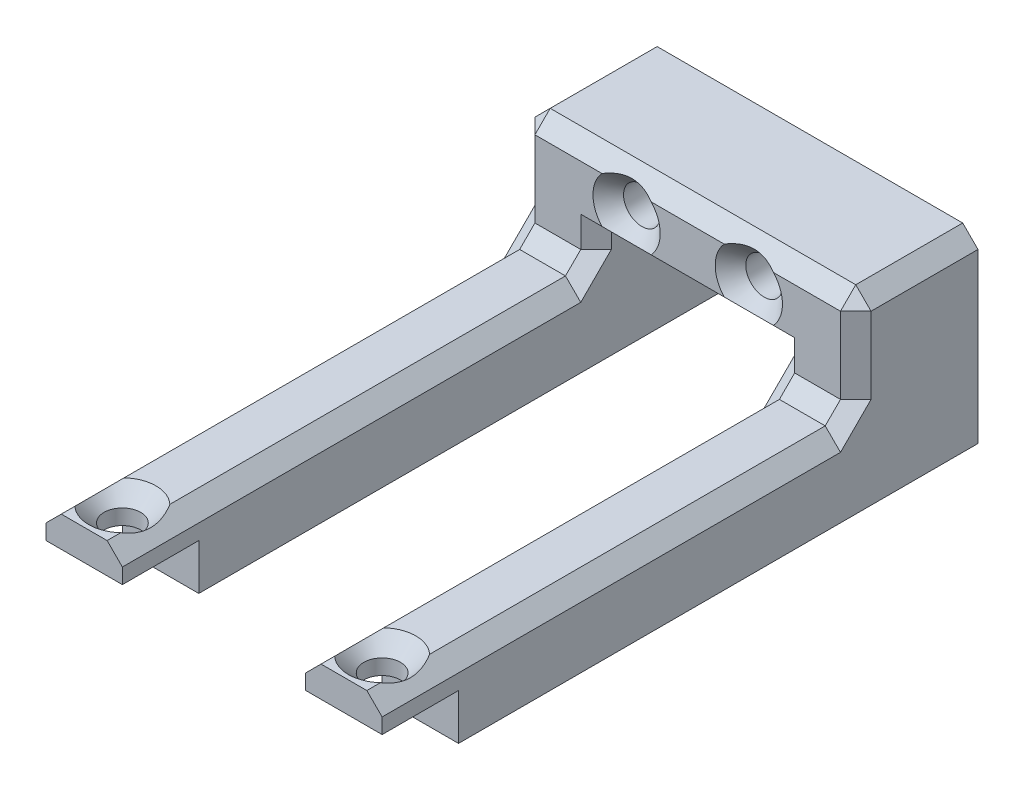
SolidWorks part; units mm, degrees
ref_plane "Plano frontal" through (0, 0, 0) normal (0, 0, 1) x (1, 0, 0)
ref_plane "Plano superior" through (0, 0, 0) normal (0, 1, 0) x (1, 0, 0)
ref_plane "Plano direito" through (0, 0, 0) normal (1, 0, 0) x (0, 0, -1)
sketch "Esboço1" plane through (0, 0, 0) normal (0, 0, 1) x (1, 0, 0)
  line L1 (0, 0) -> (22, 0)
  line L2 (0, 0) -> (0, 22)
  line L3 (0, 22) -> (22, 22)
  line L4 (22, 0) -> (22, 22)
  dimension "D1" = 22
  dimension "D2" = 22
extrude "Ressalto-extrusão1" add sketch "Esboço1" along normal blind 34
sketch "Esboço2" plane through (0, 0, 0) normal (0, 0, -1) x (-1, 0, 0)
  line L0 (0, 0) -> (-22, 0) construction
  line L1 (-17, 0) -> (-5, 0)
  line L2 (-17, 0) -> (-17, 17)
  line L3 (-17, 17) -> (-5, 17)
  line L4 (-5, 0) -> (-5, 17)
  line L5 (-22, 0) -> (-22, 22) construction
  line L6 (-22, 22) -> (0, 22) construction
  dimension "D1" = 5
  dimension "D2" = 5
  dimension "D3" = 5
extrude "Corte-extrusão1" cut sketch "Esboço2" against normal through all
sketch "Esboço3" plane through (0, 0, 34) normal (0, 0, 1) x (1, 0, 0)
  line L5 (22, 0) -> (22, 22) construction
  line L6 (0, 0) -> (22, 0)
  line L7 (0, 0) -> (0, 10)
  line L8 (0, 10) -> (22, 10)
  line L9 (22, 0) -> (22, 10)
  dimension "D1" = 12
extrude "Corte-extrusão2" cut sketch "Esboço3" against normal through all
sketch "Esboço4" plane through (0, 0, 0) normal (-1, 0, 0) x (0, 0, 1)
  line L0 (34, 22) -> (0, 22) construction
  line L1 (8, 22) -> (34, 22)
  line L2 (8, 22) -> (8, 15)
  line L3 (8, 15) -> (34, 15)
  line L4 (34, 22) -> (34, 15)
  line L5 (34, 22) -> (34, 10) construction
  line L6 (0, 22) -> (0, 10) construction
  dimension "D1" = 8
  dimension "D2" = 5
extrude "Corte-extrusão3" cut sketch "Esboço4" against normal through all
sketch "Esboço9" plane through (0, 0, 8) normal (0, 0, 1) x (1, 0, 0)
  line L0 (11, 17) -> (11, 22) construction
  line L1 (17, 17) -> (5, 17) construction
  line L2 (22, 22) -> (0, 22) construction
  line L3 (7, 19.5) -> (15, 19.5) construction
  point P9 (15, 19.5)
  point P10 (11, 19.5)
  point P11 (7, 19.5)
  dimension "D1" = 8
hole_wizard "Escareado para parafuso com cabeça escareada chata de M21" positions "3DSketch4" profile "Esboço11" countersink size "M2" standard "ISO"
sketch3d "3DSketch4"
  point P0 (7, 19.5, 8)
  point P7 (15, 19.5, 8)
  point P16 (0, 0, 0)
  point P17 (0, 0, 0)
  point P18 (0, 0, 0)
sketch "Esboço11" plane through (7, 19.5, 8) normal (1, 0, 0) x (0, -1, 0)
  line L0 (0, 0) -> (0, 8)
  line L1 (0, 8) -> (1.2, 8)
  line L2 (1.2, 8) -> (1.2, 1)
  line L3 (1.2, 1) -> (2.2, 0)
  line L5 (2.2, 0) -> (0, 0)
  line L6 (-1.2, 1) -> (-2.2, 0) construction
  line L11 (0, -6.35) -> (0, 107.95) construction
  dimension "Thru Hole Dia." = 2.4
  dimension "Thru Hole Depth" = 8
  dimension "Near C'Sink Dia." = 4.4
  dimension "Near C'Sink Angle" = 90
sketch "Esboço12" plane through (0, 0, 34) normal (0, 0, 1) x (1, 0, 0)
  line L0 (5, 10) -> (5, 15) construction
  line L1 (0, 15) -> (5, 15)
  line L2 (0, 15) -> (0, 13)
  line L3 (0, 13) -> (5, 13)
  line L4 (5, 15) -> (5, 13)
  line L5 (22, 10) -> (22, 15) construction
  line L6 (17, 15) -> (22, 15)
  line L7 (17, 15) -> (17, 13)
  line L8 (17, 13) -> (22, 13)
  line L9 (22, 15) -> (22, 13)
  dimension "D1" = 2
  dimension "D2" = 2
extrude "Ressalto-extrusão2" add sketch "Esboço12" along normal blind 5
sketch "Esboço13" plane through (0, 15, 0) normal (0, 1, 0) x (1, 0, 0)
  line L0 (2.5, -39) -> (2.5, -36.5) construction
  line L1 (5, -39) -> (0, -39) construction
  line L2 (19.5, -39) -> (19.5, -36.5) construction
  line L3 (22, -39) -> (17, -39) construction
  dimension "D1" = 2.5
  dimension "D2" = 2.5
hole_wizard "Escareado para parafuso com cabeça escareada chata de M22" positions "3DSketch5" profile "Esboço14" countersink size "M2" standard "ISO"
sketch3d "3DSketch5"
  point P0 (2.5, 15, 36.5)
  point P3 (19.5, 15, 36.5)
sketch "Esboço14" plane through (2.5, 15, 36.5) normal (1, 0, 0) x (0, 0, 1)
  line L0 (0, 0) -> (0, 5)
  line L1 (0, 5) -> (1.2, 5)
  line L2 (1.2, 5) -> (1.2, 1)
  line L3 (1.2, 1) -> (2.2, 0)
  line L5 (2.2, 0) -> (0, 0)
  line L6 (-1.2, 1) -> (-2.2, 0) construction
  line L11 (0, -6.35) -> (0, 107.95) construction
  dimension "Thru Hole Dia." = 2.4
  dimension "Thru Hole Depth" = 5
  dimension "Near C'Sink Dia." = 4.4
  dimension "Near C'Sink Angle" = 90
chamfer "Chanfro2" distance 1 angle 45 14 edges at (5, 15, 23.5) (0, 15, 23.5) (17, 16, 8) (11, 17, 8) (5, 16, 8) (2.5, 15, 8) (0, 18.5, 8) (11, 22, 8) (22, 18.5, 8) (17, 15, 23.5) (19.5, 15, 8) (22, 15, 23.5) (0, 22, 4) (22, 22, 4)
